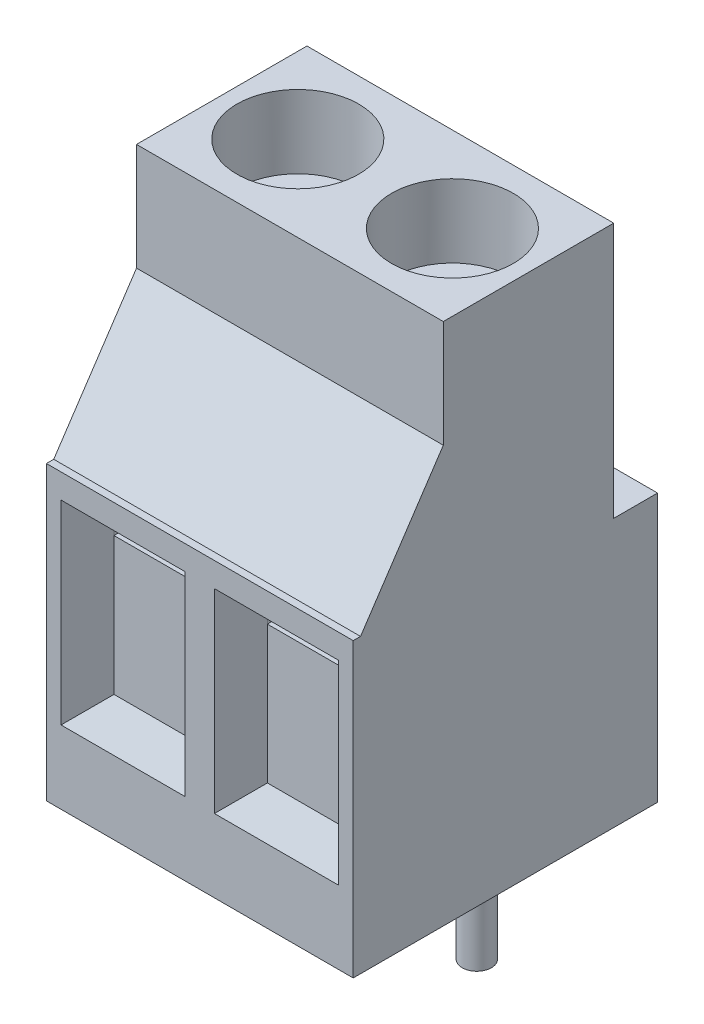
SolidWorks part; units mm, degrees
ref_plane "Front Plane" through (0, 0, 0) normal (0, 0, 1) x (1, 0, 0)
ref_plane "Top Plane" through (0, 0, 0) normal (0, 1, 0) x (1, 0, 0)
ref_plane "Right Plane" through (0, 0, 0) normal (1, 0, 0) x (0, 0, -1)
sketch "Sketch1" plane through (0, 0, 0) normal (0, 1, 0) x (1, 0, 0)
  line L0 (0, 6.25) -> (0, -6.25) construction
  line L1 (-6.3, 6.25) -> (6.3, 6.25)
  line L2 (-6.3, 6.25) -> (-6.3, -6.25)
  line L3 (-6.3, -6.25) -> (6.3, -6.25)
  line L4 (6.3, 6.25) -> (6.3, -6.25)
  dimension "D1" = 12.5
  dimension "D2" = 12.6
extrude "Extrude1" add sketch "Sketch1" along normal blind 21.5
sketch "Sketch3" plane through (0, 0, 6.25) normal (0, 0, 1) x (1, 0, 0)
  line L0 (0, 0) -> (0, 21.5) construction
  line L1 (-0.6, 3) -> (-5.7, 3)
  line L2 (-0.6, 3) -> (-0.6, 11)
  line L3 (-0.6, 11) -> (-5.7, 11)
  line L4 (-5.7, 3) -> (-5.7, 11)
  line L5 (-6.3, 21.5) -> (6.3, 21.5) construction
  line L6 (-6.3, 21.5) -> (-6.3, 0) construction
  line L7 (-6.3, 0) -> (6.3, 0) construction
  line L8 (5.7, 3) -> (5.7, 11)
  line L9 (0.6, 11) -> (5.7, 11)
  line L10 (0.6, 3) -> (0.6, 11)
  line L11 (0.6, 3) -> (5.7, 3)
  dimension "D1" = 0.6
  dimension "D2" = 0.6
  dimension "D3" = 3
  dimension "D4" = 11
extrude "WireOpenings" cut sketch "Sketch3" against normal blind 2 draft 5
sketch "Sketch4" plane through (6.3, 0, 0) normal (1, 0, 0) x (0, 0, -1)
  line L0 (-7.703, 12) -> (-5.95, 12)
  line L1 (-5.95, 12) -> (-2.55, 17.1)
  line L2 (-2.55, 17.1) -> (-2.55, 22.334)
  line L3 (-2.55, 22.334) -> (4.45, 22.334)
  line L4 (4.45, 22.334) -> (4.45, 11)
  line L5 (4.45, 11) -> (8.1066, 11)
  line L6 (8.1066, 11) -> (8.1066, 23.5315)
  line L7 (8.1066, 23.5315) -> (-7.703, 23.5315)
  line L8 (-7.703, 23.5315) -> (-7.703, 12)
  line L9 (6.25, 21.5) -> (6.25, 0) construction
  line L10 (-6.25, 21.5) -> (-6.25, 0) construction
  line L11 (-6.25, 0) -> (6.25, 0) construction
  dimension "D1" = 11
  dimension "D2" = 1.8
  dimension "D3" = 12
  dimension "D4" = 0.3
  dimension "D5" = 17.1
  dimension "D6" = 7
extrude "Profile" cut sketch "Sketch4" against normal through all
sketch "Sketch5" plane through (0, 21.5, 0) normal (0, 1, 0) x (-1, 0, 0)
  line L0 (0, 2.55) -> (0, -4.45) construction
  line L4 (-6.3, 2.55) -> (6.3, 2.55) construction
  line L5 (6.3, -4.45) -> (-6.3, -4.45) construction
  line L6 (-6.3, -0.95) -> (6.3, -0.95) construction
  line L7 (-6.3, 2.55) -> (-6.3, -4.45) construction
  line L8 (6.3, -4.45) -> (6.3, 2.55) construction
  circle A0 centre (-3.175, -0.95) radius 2.5
  circle A1 centre (3.175, -0.95) radius 2.5
  dimension "D1" = 5
  dimension "D2" = 6.35
extrude "TopScrews" cut sketch "Sketch5" against normal blind 3
sketch "Sketch6" plane through (0, 0, 0) normal (0, -1, 0) x (1, 0, 0)
  line L0 (0, -6.25) -> (0, 6.25) construction
  line L1 (6.3, -6.25) -> (-6.3, -6.25) construction
  line L2 (-6.3, 6.25) -> (6.3, 6.25) construction
  circle A0 centre (-3.175, -1.95) radius 0.6
  circle A1 centre (3.175, -1.95) radius 0.6
  dimension "D2" = 1.2
  dimension "D1" = 4.3
  dimension "D3" = 6.35
extrude "Pins" add sketch "Sketch6" along normal blind 5
sketch "Sketch7" plane through (0, 18.5, 0) normal (0, 1, 0) x (1, 0, 0)
  line L2 (-3.675, 3.3995) -> (-3.675, -1.4995)
  line L4 (-2.675, 3.3995) -> (-2.675, -1.4995)
  circle A0 centre (-3.175, 0.95) radius 2.5 construction
  arc A1 (-3.675, -1.4995) -> (-2.675, -1.4995) centre (-3.175, 0.95) ccw
  arc A2 (-2.675, 3.3995) -> (-3.675, 3.3995) centre (-3.175, 0.95) ccw
  dimension "D1" = 0.5
  dimension "D2" = 0.5
extrude "Cut-Extrude1" cut sketch "Sketch7" against normal blind 1
mirror "Mirror1" about plane through (0, 0, 0) normal (1, 0, 0) of "Cut-Extrude1"
sketch "Sketch9" plane through (0, 0, 4.25) normal (0, 0, 1) x (1, 0, 0)
  line L0 (-0.775, 10.825) -> (-5.525, 10.825) construction
  line L1 (-5.525, 10.825) -> (-0.775, 10.825)
  line L2 (-5.525, 10.825) -> (-5.525, 8.825)
  line L3 (-5.525, 8.825) -> (-0.775, 8.825)
  line L4 (-0.775, 10.825) -> (-0.775, 8.825)
  line L5 (-5.525, 10.825) -> (-5.525, 3.175) construction
  line L6 (-0.775, 3.175) -> (-0.775, 10.825) construction
  dimension "D1" = 2
extrude "Cut-Extrude2" cut sketch "Sketch9" against normal blind 8
mirror "Mirror2" about plane through (0, 0, 0) normal (1, 0, 0) of "Cut-Extrude2"
